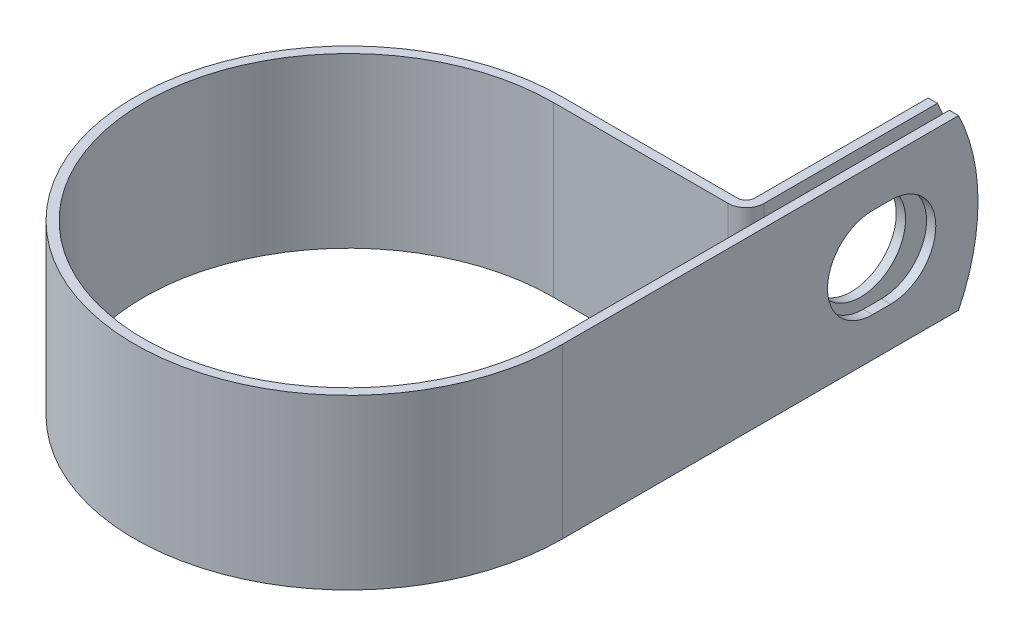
SolidWorks part; units mm, degrees
ref_plane "Front Plane" through (0, 0, 0) normal (0, 0, 1) x (1, 0, 0)
ref_plane "Top Plane" through (0, 0, 0) normal (0, 1, 0) x (1, 0, 0)
ref_plane "Right Plane" through (0, 0, 0) normal (1, 0, 0) x (0, 0, -1)
sketch "Sketch1" plane through (0, 0, 0) normal (0, 1, 0) x (1, 0, 0)
  line L0 (0, 26.9875) -> (23.0353, 26.9875)
  line L1 (26.9875, 0) -> (26.9875, 26.9875)
  line L2 (25.4127, 54.7624) -> (25.4127, 29.3649)
  line L5 (26.9875, 26.9875) -> (26.9875, 54.7624)
  arc A0 (0, 26.9875) -> (26.9875, 0) centre (0, 0) ccw
  arc A3 (23.0353, 26.9875) -> (25.4127, 29.3649) centre (23.0353, 29.3649) ccw
extrude "Extrude-Thin1" add sketch "Sketch1" along normal mid plane 22.225 thin
sketch "Sketch2" plane through (24.1935, 0, 0) normal (-1, 0, 0) x (0, 0, 1)
  line L0 (-54.7624, 11.1125) -> (-54.7624, -11.1125) construction
  line L7 (0, 11.1125) -> (0, -11.1125) construction
  circle A0 centre (-42.0624, 0) radius 5.9436
  point P2 (-54.7624, 0)
extrude "Cut-Extrude1" cut sketch "Sketch2" against normal up to surface (1.2192 mm away)
sketch "Sketch3" plane through (28.2067, 0, 0) normal (1, 0, 0) x (0, 0, -1)
  line L0 (40.8686, 0) -> (43.2562, 0) construction
  line L1 (40.8686, 5.9436) -> (43.2562, 5.9436)
  line L2 (40.8686, -5.9436) -> (43.2562, -5.9436)
  line L3 (54.7624, 11.1125) -> (54.7624, -11.1125) construction
  arc A0 (40.8686, 5.9436) -> (40.8686, -5.9436) centre (40.8686, 0) ccw
  arc A1 (43.2562, -5.9436) -> (43.2562, 5.9436) centre (43.2562, 0) ccw
  point P3 (42.0624, 0)
  point P8 (54.7624, 0)
  point P11 (34.925, 0)
  point P12 (49.1998, 0)
extrude "Cut-Extrude2" cut sketch "Sketch3" against normal up to surface (1.2192 mm away)
sketch "Sketch4" plane through (24.1935, 0, 0) normal (-1, 0, 0) x (0, 0, 1)
  line L0 (-54.7624, 11.1125) -> (-54.7624, -11.1125)
  line L1 (-54.7624, 11.1125) -> (-52.2025, 11.1125)
  line L2 (-54.7624, 11.1125) -> (-29.3649, 11.1125) construction
  line L3 (-54.7624, -11.1125) -> (-52.2025, -11.1125)
  line L4 (-54.7624, -11.1125) -> (-29.3649, -11.1125) construction
  arc A0 (-52.2025, 11.1125) -> (-52.2025, -11.1125) centre (-29.3624, 0) ccw
extrude "Cut-Extrude3" cut sketch "Sketch4" against normal through all contours A0 M4 M5 | A0 L0 M2
equation "\"D1@Sketch3\" = \"D2@Sketch2\""
equation "\"D7@Sketch1\" = \"D3@Sketch2\" + \"D1@Sketch3\""
equation "\"D1@Sketch4\" = ( \"D1@Extrude-Thin1\" + .125 ) * 2"
equation "\"D2@Sketch1\"=1.95*\"D5@Extrude-Thin1\""
equation "\"D2@Sketch3\" = \"D1@Sketch2\""
